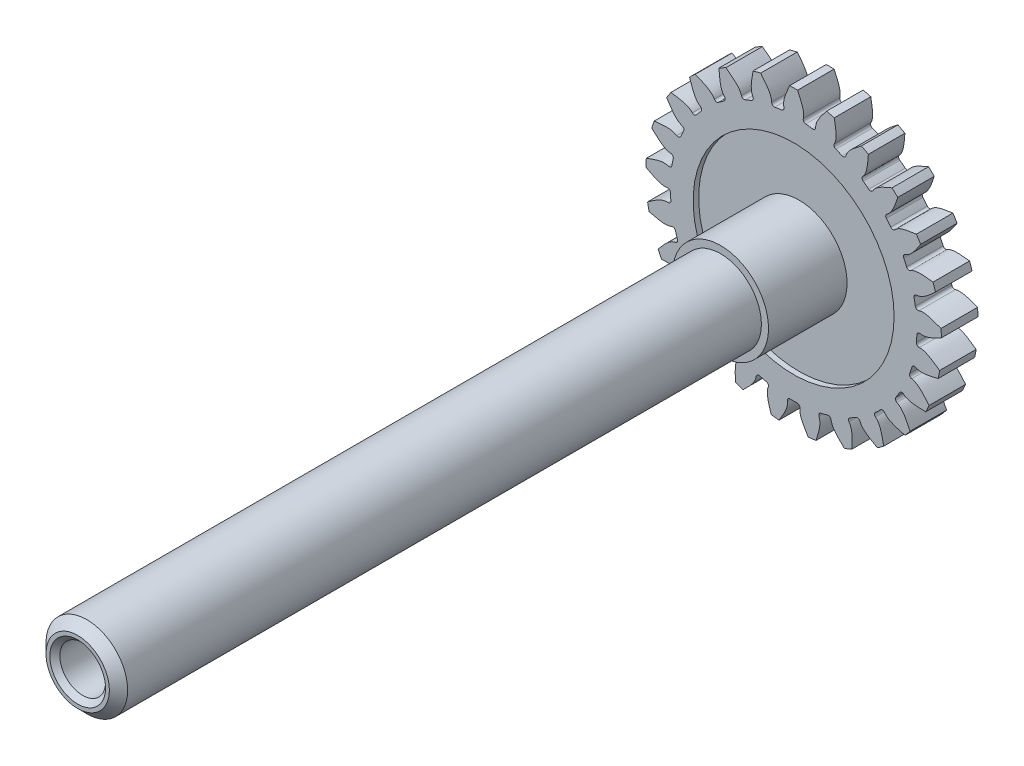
SolidWorks part; units mm, degrees
ref_plane "Face" through (0, 0, 0) normal (0, 0, 1) x (1, 0, 0)
ref_plane "Dessus" through (0, 0, 0) normal (0, 1, 0) x (1, 0, 0)
ref_plane "Droite" through (0, 0, 0) normal (1, 0, 0) x (0, 0, -1)
other "Joindre1"
other "arbre<1>@Z8-sortie"
other "Roue Z8 m=0,6 Z=25<1>@Z8-sortie"
sketch "Dp" plane through (0, 0, 0) normal (0, 0, 1) x (1, 0, 0)
  circle A0 centre (0, 0) radius 7.5 construction
  dimension "D1" = 15
sketch "Esquisse1" plane through (0, 0, -8) normal (0, 0, -1) x (-1, 0, 0)
  circle A0 centre (0, 0) radius 1.3765 construction
  circle A1 centre (0, 0) radius 2.625 construction
  circle A2 centre (0, 0) radius 1.3765
  circle A3 centre (0, 0) radius 2.625
extrude "Boss.-Extru.1" add sketch "Esquisse1" along normal blind 0.3
